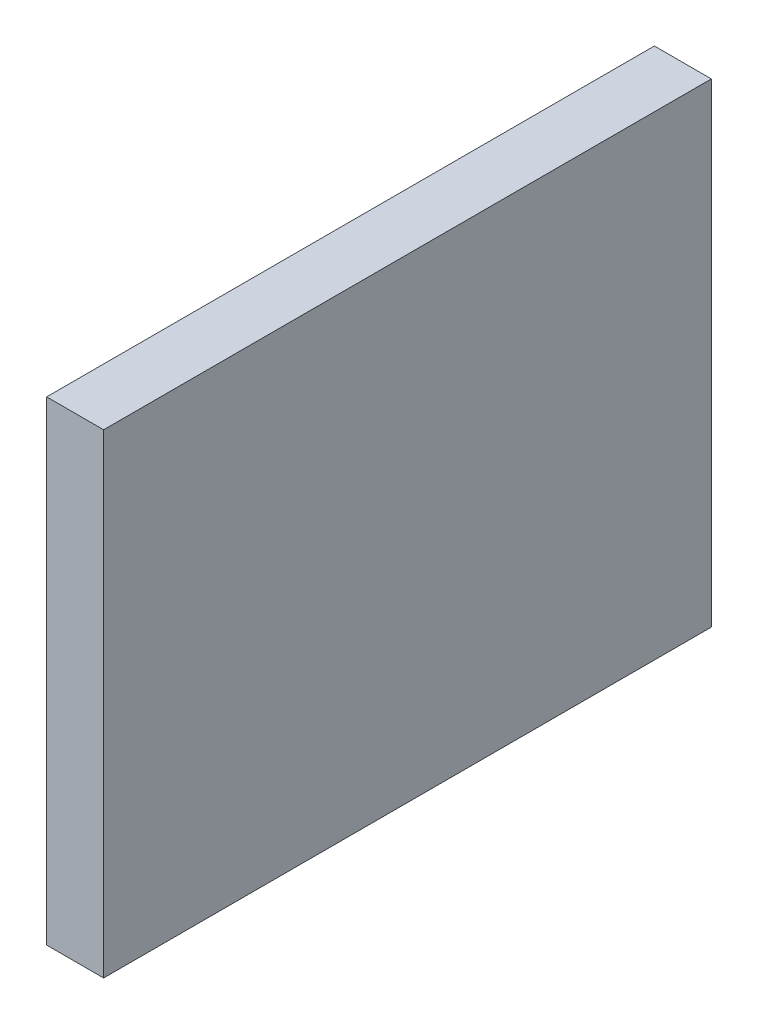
SolidWorks part; units mm, degrees
ref_plane "Front Plane" through (0, 0, 0) normal (0, 0, 1) x (1, 0, 0)
ref_plane "Top Plane" through (0, 0, 0) normal (0, 1, 0) x (1, 0, 0)
ref_plane "Right Plane" through (0, 0, 0) normal (1, 0, 0) x (0, 0, -1)
sketch "Sketch1" plane through (0, 0, 0) normal (1, 0, 0) x (0, 0, -1)
  line L1 (0, 0) -> (32.512, 0)
  line L2 (0, 0) -> (0, 25.4)
  line L3 (0, 25.4) -> (32.512, 25.4)
  line L4 (32.512, 0) -> (32.512, 25.4)
  dimension "D1" = 25.4
  dimension "D2" = 32.512
extrude "Boss-Extrude1" add sketch "Sketch1" along normal blind 3.048
